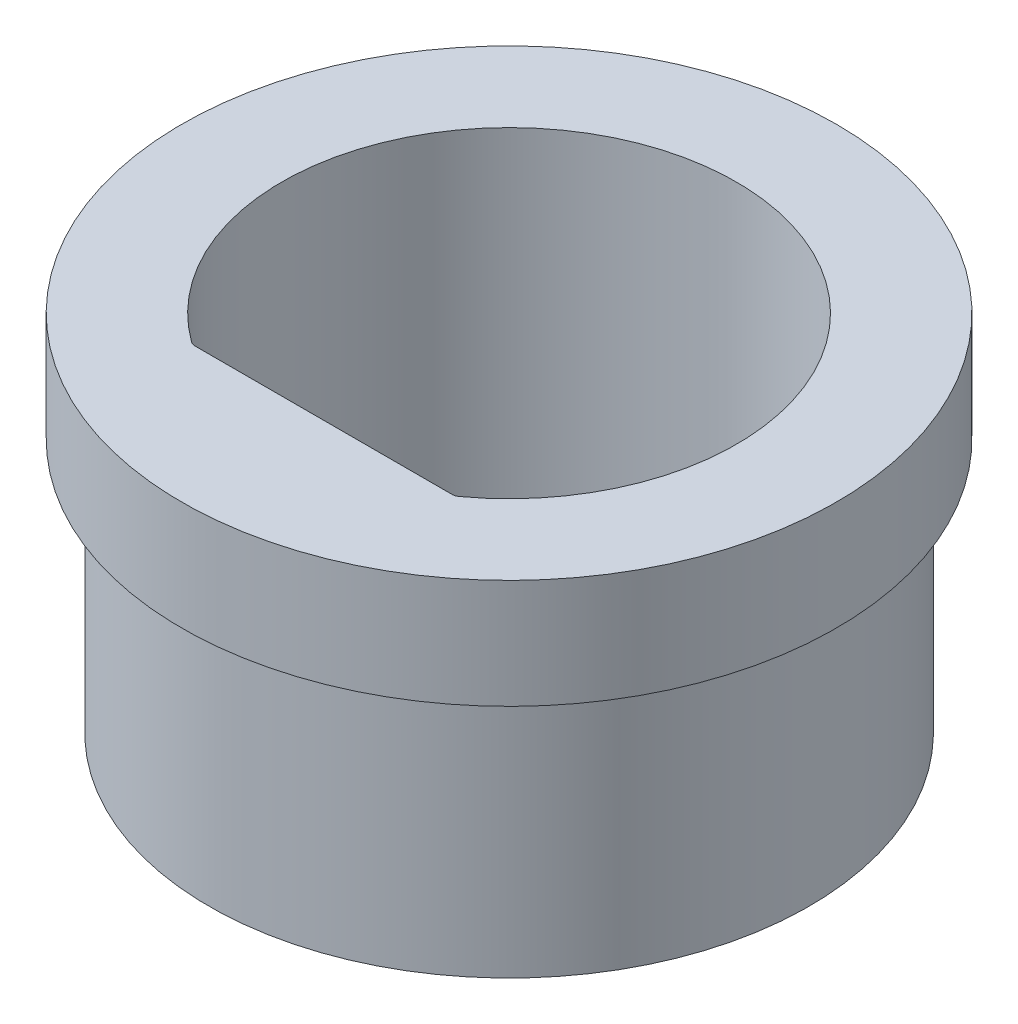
SolidWorks part; units mm, degrees
ref_plane "Face" through (0, 0, 0) normal (0, 0, 1) x (1, 0, 0)
ref_plane "Dessus" through (0, 0, 0) normal (0, 1, 0) x (1, 0, 0)
ref_plane "Droite" through (0, 0, 0) normal (1, 0, 0) x (0, 0, -1)
sketch "Esquisse1" plane through (0, 0, 0) normal (0, 0, 1) x (1, 0, 0)
  line L0 (0, 0) -> (0, 42.1864) construction
  line L1 (0, 20) -> (0, 0)
  line L2 (0, 0) -> (16.5, 0)
  line L3 (16.5, 0) -> (16.5, 14)
  line L4 (16.5, 14) -> (18, 14)
  line L5 (18, 14) -> (18, 20)
  line L6 (18, 20) -> (0, 20)
  dimension "D1" = 36
  dimension "D2" = 33
  dimension "D3" = 14
  dimension "D4" = 20
revolve "Révolution1" add sketch "Esquisse1" angle 360 about L0
sketch "Esquisse2" plane through (0, 20, 0) normal (0, 1, 0) x (-1, 0, 0)
  line L0 (-7.2256, 10.2) -> (7.2256, 10.2)
  arc A0 (-7.2256, 10.2) -> (7.2256, 10.2) centre (0, 0) ccw
  dimension "D1" = 25
  dimension "D2" = 10.2
extrude "Enlèv. mat.-Extru.1" cut sketch "Esquisse2" against normal through all
fillet "Congé1" radius 0.5 2 edges at (-7.2256, 10, 10.2) (7.2256, 10, 10.2)
